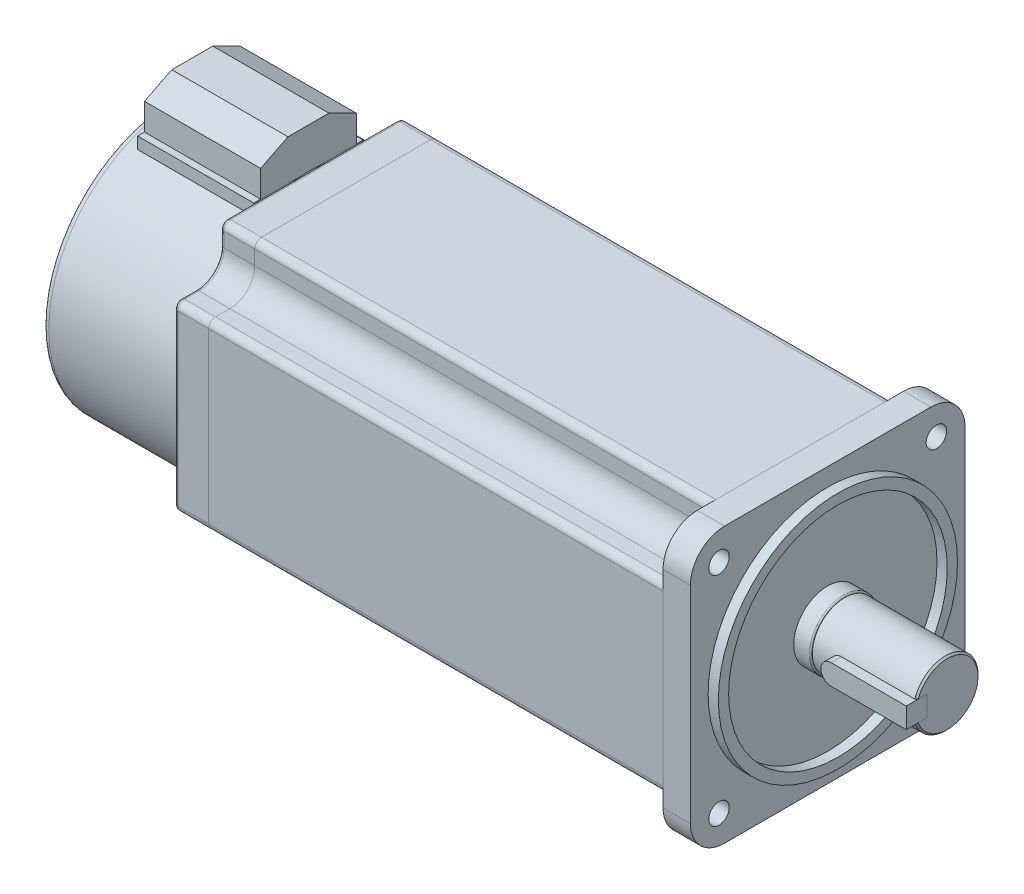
SolidWorks part; units mm, degrees
ref_plane "前视基准面" through (0, 0, 0) normal (0, 0, 1) x (1, 0, 0)
ref_plane "上视基准面" through (0, 0, 0) normal (0, 1, 0) x (1, 0, 0)
ref_plane "右视基准面" through (0, 0, 0) normal (1, 0, 0) x (0, 0, -1)
sketch "草图1" plane through (0, 0, 0) normal (1, 0, 0) x (0, 0, -1)
  line L1 (-30.2, -40.2) -> (30.2, -40.2)
  line L2 (-40.2, -30.2) -> (-40.2, 30.2)
  line L3 (-30.2, 40.2) -> (30.2, 40.2)
  line L4 (40.2, -30.2) -> (40.2, 30.2)
  line L5 (-40.2, -40.2) -> (40.2, 40.2) construction
  line L6 (-40.2, 40.2) -> (40.2, -40.2) construction
  arc A0 (30.2, -40.2) -> (40.2, -30.2) centre (30.2, -30.2) ccw
  arc A1 (-30.2, -40.2) -> (-40.2, -30.2) centre (-30.2, -30.2) cw
  arc A2 (-40.2, 30.2) -> (-30.2, 40.2) centre (-30.2, 30.2) cw
  arc A3 (30.2, 40.2) -> (40.2, 30.2) centre (30.2, 30.2) cw
  point P0 (0, 0)
  dimension "D1" = 10
extrude "凸台-拉伸1" add sketch "草图1" along normal blind 8
sketch "草图2" plane through (0, 0, 0) normal (-1, 0, 0) x (0, 0, 1)
  line L0 (-30.2, 40.2) -> (30.2, 40.2) construction
  line L1 (-30.2, -40.2) -> (30.2, -40.2)
  line L2 (-40.2, -30.2) -> (-40.2, 30.2)
  line L3 (-30.2, 40.2) -> (30.2, 40.2)
  line L4 (40.2, -30.2) -> (40.2, 30.2)
  line L5 (-40.2, -40.2) -> (40.2, 40.2) construction
  line L6 (-40.2, 40.2) -> (40.2, -40.2) construction
  arc A0 (-30.2, -40.2) -> (-40.2, -30.2) centre (-30.2, -30.2) cw
  arc A1 (30.2, -40.2) -> (40.2, -30.2) centre (30.2, -30.2) ccw
  arc A2 (30.2, 40.2) -> (40.2, 30.2) centre (30.2, 30.2) cw
  arc A3 (-40.2, 30.2) -> (-30.2, 40.2) centre (-30.2, 30.2) cw
  point P0 (0, 0)
  dimension "D1" = 10
extrude "凸台-拉伸2" add sketch "草图2" along normal blind 133 separate body
sketch "草图3" plane through (-133, 0, 0) normal (-1, 0, 0) x (0, 0, 1)
  line L0 (30.2, 40.2) -> (-30.2, 40.2) construction
  line L1 (-30.2, -40.2) -> (30.2, -40.2)
  line L2 (-40.2, -30.2) -> (-40.2, 30.2)
  line L3 (-30.2, 40.2) -> (30.2, 40.2)
  line L4 (40.2, -30.2) -> (40.2, 30.2)
  line L5 (-40.2, -40.2) -> (40.2, 40.2) construction
  line L6 (-40.2, 40.2) -> (40.2, -40.2) construction
  arc A0 (30.2, 40.2) -> (40.2, 30.2) centre (30.2, 30.2) cw
  arc A1 (30.2, -40.2) -> (40.2, -30.2) centre (30.2, -30.2) ccw
  arc A2 (-30.2, -40.2) -> (-40.2, -30.2) centre (-30.2, -30.2) cw
  arc A3 (-40.2, 30.2) -> (-30.2, 40.2) centre (-30.2, 30.2) cw
  point P0 (0, 0)
  dimension "D1" = 10
extrude "凸台-拉伸3" add sketch "草图3" along normal blind 10 separate body
sketch "草图4" plane through (-143, 0, 0) normal (-1, 0, 0) x (0, 0, 1)
  line L0 (-34, -26.7281) -> (-38.2, -26.7281)
  line L1 (-40.2, 24.7281) -> (-40.2, 30.2)
  line L3 (-30.2, 40.2) -> (-24.7281, 40.2)
  line L4 (24.7281, 40.2) -> (30.2, 40.2)
  line L6 (40.2, 30.2) -> (40.2, 24.7281)
  line L7 (-40.2, 30.2) -> (-40.2, -30.2) construction
  line L8 (40.2, -24.7281) -> (40.2, -30.2)
  line L9 (-38.2, 26.7281) -> (-34, 26.7281)
  line L11 (-26.7281, 34) -> (-26.7281, 38.2)
  line L12 (30.2, 40.2) -> (-30.2, 40.2) construction
  line L13 (30.2, -40.2) -> (24.7281, -40.2)
  line L14 (26.7281, 38.2) -> (26.7281, 34)
  line L15 (-24.7281, -40.2) -> (-30.2, -40.2)
  line L16 (34, 26.7281) -> (38.2, 26.7281)
  line L17 (40.2, -30.2) -> (40.2, 30.2) construction
  line L19 (38.2, -26.7281) -> (34, -26.7281)
  line L20 (-40.2, -30.2) -> (-40.2, -24.7281)
  line L21 (26.7281, -34) -> (26.7281, -38.2)
  line L22 (-30.2, -40.2) -> (30.2, -40.2) construction
  line L24 (-26.7281, -38.2) -> (-26.7281, -34)
  arc A0 (-34, 26.7281) -> (-26.7281, 34) centre (-34, 34) ccw
  arc A1 (26.7281, 34) -> (34, 26.7281) centre (34, 34) ccw
  arc A2 (34, -26.7281) -> (26.7281, -34) centre (34, -34) ccw
  arc A3 (-26.7281, -34) -> (-34, -26.7281) centre (-34, -34) ccw
  arc A4 (-30.2, 40.2) -> (-40.2, 30.2) centre (-30.2, 30.2) ccw
  arc A5 (40.2, 30.2) -> (30.2, 40.2) centre (30.2, 30.2) ccw
  arc A6 (30.2, -40.2) -> (40.2, -30.2) centre (30.2, -30.2) ccw
  arc A8 (-38.2, -26.7281) -> (-40.2, -24.7281) centre (-38.2, -24.7281) cw
  arc A9 (-24.7281, -40.2) -> (-26.7281, -38.2) centre (-24.7281, -38.2) cw
  arc A10 (26.7281, -38.2) -> (24.7281, -40.2) centre (24.7281, -38.2) cw
  arc A11 (40.2, -24.7281) -> (38.2, -26.7281) centre (38.2, -24.7281) cw
  arc A12 (38.2, 26.7281) -> (40.2, 24.7281) centre (38.2, 24.7281) cw
  arc A13 (24.7281, 40.2) -> (26.7281, 38.2) centre (24.7281, 38.2) cw
  arc A14 (-26.7281, 38.2) -> (-24.7281, 40.2) centre (-24.7281, 38.2) cw
  arc A15 (-40.2, 24.7281) -> (-38.2, 26.7281) centre (-38.2, 24.7281) cw
  arc A16 (-40.2, -30.2) -> (-30.2, -40.2) centre (-30.2, -30.2) ccw
  point P0 (0, 0)
  point P48 (-40.2, -26.7281)
  point P51 (-26.7281, -40.2)
  point P54 (26.7281, -40.2)
  point P57 (40.2, -26.7281)
  point P60 (40.2, 26.7281)
  point P63 (26.7281, 40.2)
  point P66 (-26.7281, 40.2)
  point P69 (-40.2, 26.7281)
  dimension "D1" = 2
extrude "切除-拉伸1" cut sketch "草图4" against normal blind 143
fillet "圆角1" radius 1 24 edges at (-143, -28.858, -28.858) (-143, -26.7281, -36.1) (-143, -26.1423, -39.6142) (-143, 0, -40.2) (-143, 26.1423, -39.6142) (-143, 26.7281, -36.1) (-143, 28.858, -28.858) (-143, 36.1, -26.7281) (-143, 39.6142, -26.1423) (-143, 40.2, 0) (-143, 39.6142, 26.1423) (-143, 36.1, 26.7281) (-143, 28.858, 28.858) (-143, 26.7281, 36.1) (-143, 26.1423, 39.6142) (-143, 0, 40.2) (-143, -26.1423, 39.6142) (-143, -26.7281, 36.1) (-143, -28.858, 28.858) (-143, -36.1, 26.7281) (-143, -39.6142, 26.1423) (-143, -40.2, 0) (-143, -39.6142, -26.1423) (-143, -36.1, -26.7281)
sketch "草图5" plane through (8, 0, 0) normal (1, 0, 0) x (0, 0, -1)
  circle A2 centre (-31.8198, 31.8198) radius 3
  circle A3 centre (31.8198, 31.8198) radius 3
  circle A4 centre (-31.8198, -31.8198) radius 3
  circle A5 centre (31.8198, -31.8198) radius 3
extrude "切除-拉伸2" cut sketch "草图5" against normal blind 8
sketch "草图6" plane through (8, 0, 0) normal (1, 0, 0) x (0, 0, -1)
  circle A0 centre (0, 0) radius 35
  circle A1 centre (0, 0) radius 32
extrude "凸台-拉伸4" add sketch "草图6" along normal blind 3
sketch "草图7" plane through (8, 0, 0) normal (1, 0, 0) x (0, 0, -1)
  circle A0 centre (0, 0) radius 9.95
extrude "凸台-拉伸5" add sketch "草图7" along normal blind 5
fillet "圆角2" radius 0.4 1 edges at (13, 0, -9.95)
sketch "草图8" plane through (13, 0, 0) normal (1, 0, 0) x (0, 0, -1)
  circle A0 centre (0, 0) radius 9.5
extrude "凸台-拉伸6" add sketch "草图8" along normal blind 30 separate body
ref_plane "基准面1" through (0, 0, 9.5) normal (0, 0, 1) x (1, 0, 0)
sketch "草图9" plane through (0, 0, 9.5) normal (0, 0, 1) x (1, 0, 0)
  line L1 (43, -9.5) -> (43, 9.5) construction
  line L2 (21, 3) -> (43, 3)
  line L3 (43, 3) -> (43, -3)
  line L4 (43, -3) -> (21, -3)
  arc A0 (21, 3) -> (21, -3) centre (21, 0) ccw
extrude "切除-拉伸3" cut sketch "草图9" against normal blind 3.5
sketch "草图10" plane through (0, 0, 6) normal (0, 0, 1) x (1, 0, 0)
  line L0 (21, 3) -> (43, 3)
  line L1 (43, 3) -> (43, -3)
  line L2 (43, -3) -> (21, -3)
  arc A0 (21, 3) -> (21, -3) centre (21, 0) ccw
extrude "凸台-拉伸7" add sketch "草图10" along normal blind 6 separate body
chamfer "倒角1" distance 0.5 angle 45 1 edges at (43, 0, -9.5)
sketch "草图11" plane through (-143, 0, 0) normal (-1, 0, 0) x (0, 0, 1)
  circle A0 centre (0, 0) radius 39
extrude "凸台-拉伸8" add sketch "草图11" along normal blind 40 separate body
fillet "圆角3" radius 2 1 edges at (-183, 0, 39)
ref_plane "基准面2" through (0, 39, 0) normal (0, 1, 0) x (1, 0, 0)
sketch "草图12" plane through (0, 39, 0) normal (0, 1, 0) x (1, 0, 0)
  line L4 (-178, -16) -> (-144, -16)
  line L5 (-178, -16) -> (-178, 16)
  line L6 (-178, 16) -> (-144, 16)
  line L7 (-144, -16) -> (-144, 16)
  line L8 (-178, -16) -> (-144, 16) construction
  line L9 (-178, 16) -> (-144, -16) construction
extrude "切除-拉伸4" cut sketch "草图12" against normal blind 5
sketch "草图13" plane through (0, 34, 0) normal (0, 1, 0) x (1, 0, 0)
  line L1 (-178, -16) -> (-144, -16)
  line L2 (-178, -16) -> (-178, 16)
  line L3 (-178, 16) -> (-144, 16)
  line L4 (-144, -16) -> (-144, 16)
  line L5 (-178, -16) -> (-144, 16) construction
  line L6 (-178, 16) -> (-144, -16) construction
  point P0 (-161, 0)
extrude "凸台-拉伸9" add sketch "草图13" along normal blind 5
sketch "草图14" plane through (0, 39, 0) normal (0, 1, 0) x (1, 0, 0)
  line L0 (-144, 0) -> (-144, 16) construction
  line L1 (-178, -14) -> (-144, -14)
  line L2 (-178, -14) -> (-178, 14)
  line L3 (-178, 14) -> (-144, 14)
  line L4 (-144, -14) -> (-144, 14)
  line L5 (-178, -14) -> (-144, 14) construction
  line L6 (-178, 14) -> (-144, -14) construction
  point P0 (-161, 0)
extrude "凸台-拉伸10" add sketch "草图14" along normal blind 11.8 separate body
sketch "草图19" plane through (-178, 0, 0) normal (-1, 0, 0) x (0, 0, 1)
  line L0 (-14, 50.8) -> (-14, 46.8)
  line L1 (-14, 50.8) -> (-14, 39) construction
  line L2 (14, 50.8) -> (14, 46.8)
  line L3 (14, 50.8) -> (14, 39) construction
  line L4 (-14, 50.8) -> (-6, 50.8)
  line L5 (-14, 50.8) -> (14, 50.8) construction
  line L6 (14, 50.8) -> (6, 50.8)
  line L7 (-14, 46.8) -> (-6, 50.8)
  line L8 (6, 50.8) -> (14, 46.8)
extrude "切除-拉伸5" cut sketch "草图19" against normal blind 34
